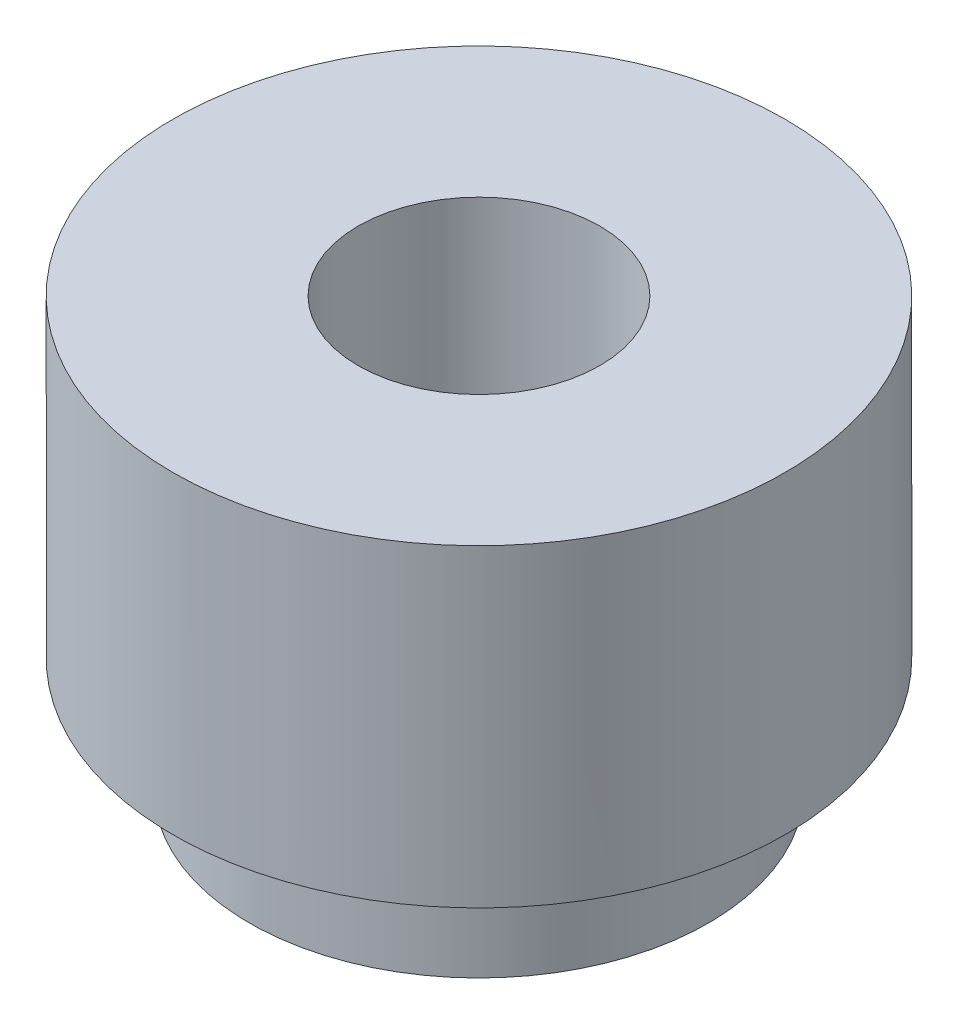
SolidWorks part; units mm, degrees
ref_plane "Front" through (0, 0, 0) normal (0, 0, 1) x (1, 0, 0)
ref_plane "Top" through (0, 0, 0) normal (0, 1, 0) x (1, 0, 0)
ref_plane "Right" through (0, 0, 0) normal (1, 0, 0) x (0, 0, -1)
sketch "Sketch1" plane through (0, 0, 0) normal (0, 1, 0) x (1, 0, 0)
  circle A0 centre (0, 0) radius 10.033
  circle A1 centre (0, 0) radius 25.4
  dimension "D1" = 50.8
  dimension "D2" = 20.066
extrude "Extrude1" add sketch "Sketch1" along normal blind 35.56
sketch "Sketch2" plane through (0, 0, 0) normal (0, 0, 1) x (1, 0, 0)
  line L0 (-25.4, 0) -> (25.4, 0) construction
  line L1 (25.4, 0) -> (19.05, 0)
  line L2 (25.4, 0) -> (25.4, 9.525)
  line L3 (25.4, 9.525) -> (19.05, 9.525)
  line L4 (19.05, 0) -> (19.05, 9.525)
  line L5 (0, 0) -> (0, 24.082) construction
  line L6 (25.4, 0) -> (25.4, 35.56) construction
  dimension "D1" = 9.525
  dimension "D2" = 38.1
revolve "Cut-Revolve1" cut sketch "Sketch2" angle 360 about L5
